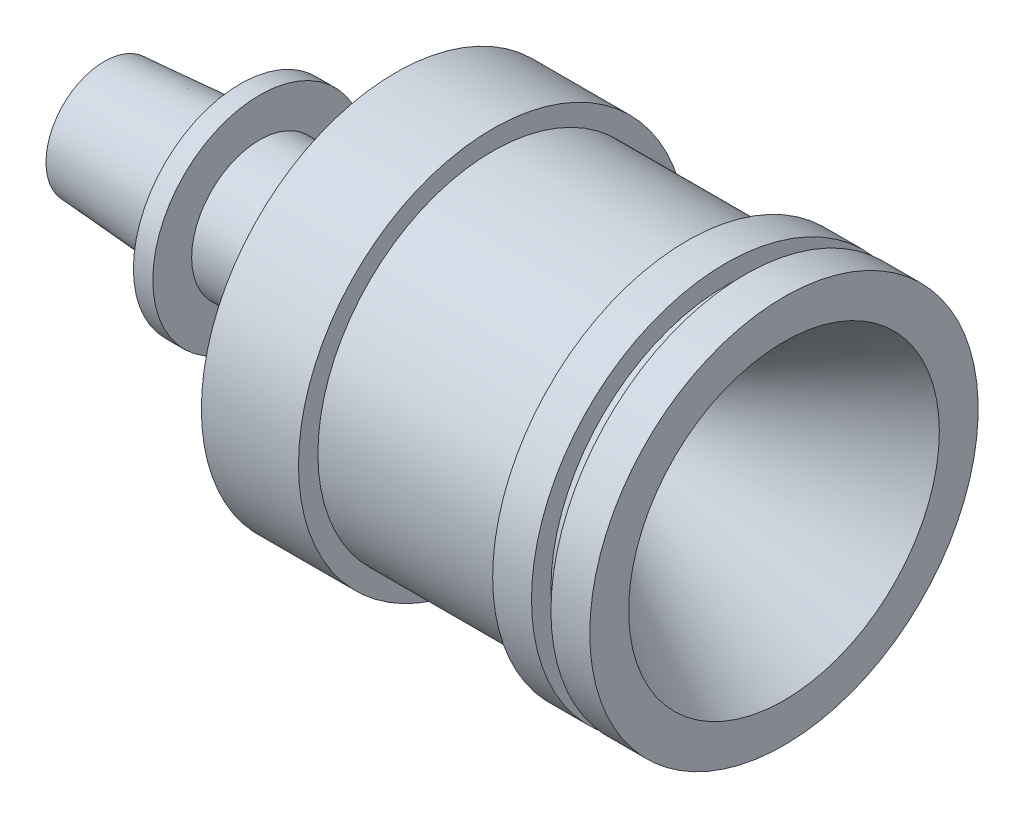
SolidWorks part; units mm, degrees
ref_plane "Plan de face" through (0, 0, 0) normal (0, 0, 1) x (1, 0, 0)
ref_plane "Plan de dessus" through (0, 0, 0) normal (0, 1, 0) x (1, 0, 0)
ref_plane "Plan de droite" through (0, 0, 0) normal (1, 0, 0) x (0, 0, -1)
sketch "Esquisse1" plane through (0, 0, 0) normal (0, 0, 1) x (1, 0, 0)
  line L0 (0, 0) -> (112.6865, 0) construction
  line L1 (0, 0) -> (0, 3)
  line L2 (20, 10) -> (20, 9)
  line L3 (7, 3.5) -> (7, 5.5)
  line L4 (7, 5.5) -> (8, 5.5)
  line L5 (8, 5.5) -> (8, 3.5)
  line L6 (8, 3.5) -> (15, 3.5)
  line L7 (15, 3.5) -> (15, 10)
  line L8 (15, 10) -> (20, 10)
  line L9 (35, 10) -> (35, 8)
  line L10 (35, 8) -> (24.2066, 1.273)
  line L11 (7, 3.5) -> (0, 3)
  line L12 (20, 9) -> (30, 9)
  line L13 (30, 9) -> (30, 10)
  line L14 (30, 10) -> (32, 10)
  line L15 (0, 0) -> (23.5, 0)
  line L16 (32, 10) -> (32, 9)
  line L17 (32, 9) -> (33, 9)
  line L18 (33, 9) -> (33, 10)
  line L19 (33, 10) -> (35, 10)
  arc A0 (24.2066, 1.273) -> (23.5, 0) centre (25, 0) ccw
  point P21 (25, 0)
  dimension "D9" = 3
  dimension "D1" = 35
  dimension "D2" = 10
  dimension "D3" = 3.5
  dimension "D4" = 5.5
  dimension "D5" = 1
  dimension "D6" = 7
  dimension "D7" = 20
  dimension "D8" = 2
  dimension "D10" = 3
  dimension "D11" = 10
  dimension "D12" = 1
  dimension "D13" = 10
  dimension "D14" = 5
  dimension "D15" = 1
  dimension "D16" = 2
  dimension "D17" = 1
revolve "Révolution1" add sketch "Esquisse1" angle 360 about L0
sketch "Esquisse2" plane through (0, 0, 0) normal (0, 0, 1) x (1, 0, 0)
  point P0 (25, 0)
